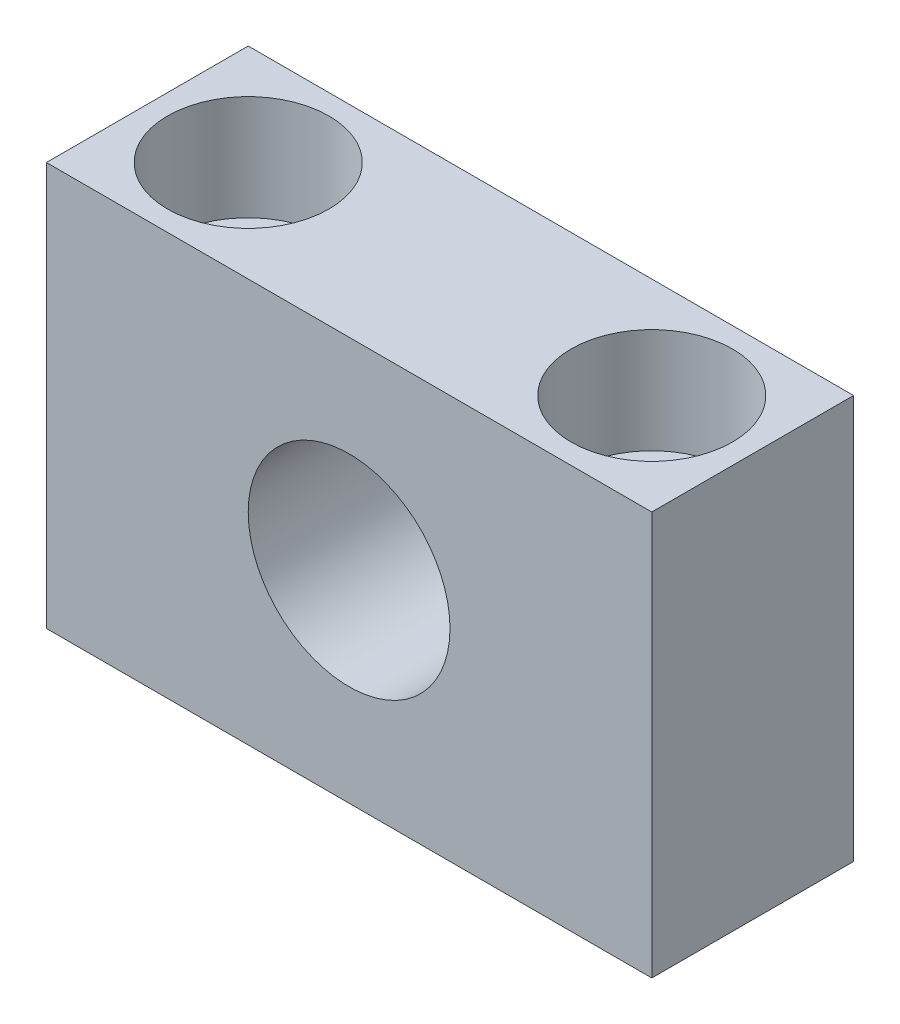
SolidWorks part; units mm, degrees
ref_plane "Спереди" through (0, 0, 0) normal (0, 0, 1) x (1, 0, 0)
ref_plane "Сверху" through (0, 0, 0) normal (0, 1, 0) x (1, 0, 0)
ref_plane "Справа" through (0, 0, 0) normal (1, 0, 0) x (0, 0, -1)
sketch "Эскиз1" plane through (0, 0, 0) normal (0, 0, 1) x (1, 0, 0)
  line L1 (-65, 25) -> (65, 25)
  line L2 (-65, 25) -> (-65, -25)
  line L3 (-65, -25) -> (65, -25)
  line L4 (65, 25) -> (65, -25)
  line L5 (-65, 25) -> (65, -25) construction
  line L6 (-65, -25) -> (65, 25) construction
  circle A0 centre (0, 0) radius 12.5
  point P0 (0, 0)
  dimension "D2" = 25
  dimension "D1" = 130
  dimension "D3" = 50
extrude "Бобышка-Вытянуть1" add sketch "Эскиз1" along normal blind 25
hole_wizard "CBORE for M12 Hex Socket Head Cap Screw Class A 117381" positions "Эскиз4" profile "Эскиз2" counterbore size "M12" standard "GOST"
sketch "Эскиз4" plane through (0, 25, 0) normal (0, 1, 0) x (1, 0, 0)
  line L0 (-50, -12.5) -> (-25, -12.5) construction
  line L1 (-25, -12.5) -> (25, -12.5) construction
  line L2 (25, -12.5) -> (50, -12.5) construction
  line L5 (0, 0) -> (0, -12.5) construction
  point P0 (-50, -12.5)
  point P2 (-25, -12.5)
  point P4 (25, -12.5)
  point P6 (50, -12.5)
  dimension "D1" = 50
  dimension "D2" = 100
  dimension "D3" = 12.5
sketch "Эскиз2" plane through (-50, 25, 12.5) normal (1, 0, 0) x (0, 0, 1)
  line L0 (0, 0) -> (0, 50)
  line L1 (0, 50) -> (6.75, 50)
  line L3 (6.75, 50) -> (6.75, 13)
  line L4 (6.75, 13) -> (10, 13)
  line L5 (10, 13) -> (10, 0)
  line L7 (10, 0) -> (0, 0)
  line L11 (0, -6.35) -> (0, 107.95) construction
  dimension "Диаметр сквозного отверстия" = 13.5
  dimension "Глубина сквозного отверстия" = 50
  dimension "Диаметр цековки" = 20
  dimension "Глубина цековки" = 13
sketch "Эскиз5" plane through (0, 0, 0) normal (0, 0, 1) x (1, 0, 0)
  line L0 (-65, -25) -> (65, -25) construction
  line L1 (-37.5, 25) -> (37.5, 25)
  line L2 (-37.5, 25) -> (-37.5, -25)
  line L3 (-37.5, -25) -> (37.5, -25)
  line L4 (37.5, 25) -> (37.5, -25)
  line L5 (-37.5, 25) -> (37.5, -25) construction
  line L6 (-37.5, -25) -> (37.5, 25) construction
  point P0 (0, 0)
  dimension "D1" = 75
extrude "Вырез-Вытянуть1" cut sketch "Эскиз5" along normal blind 25 flip side to cut
